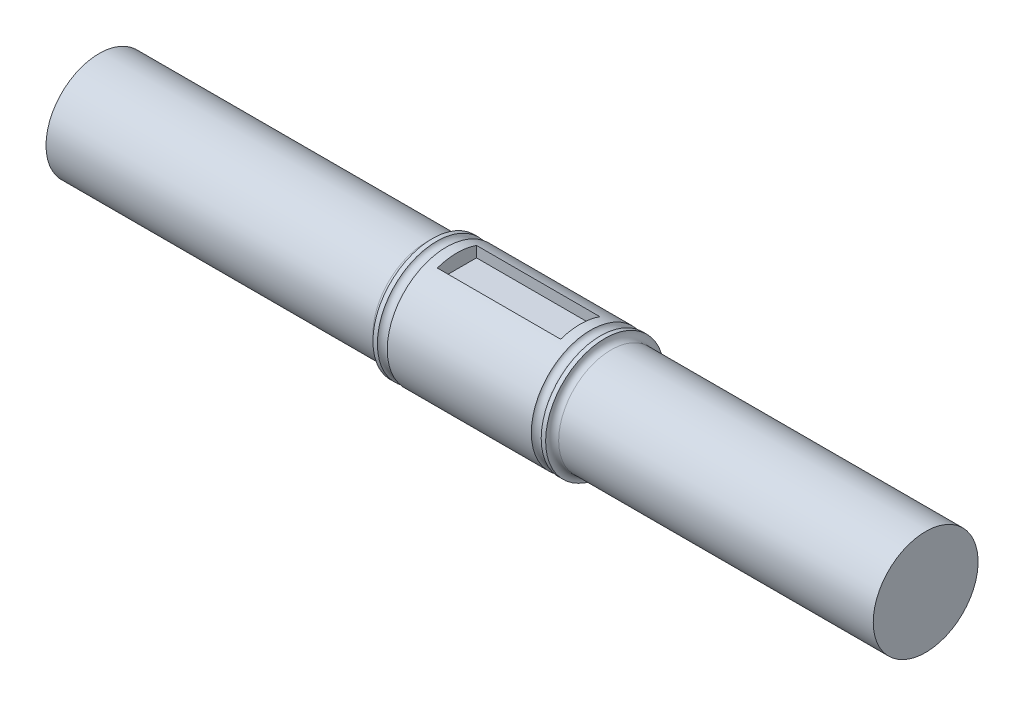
SolidWorks part; units mm, degrees
ref_plane "Front Plane" through (0, 0, 0) normal (0, 0, 1) x (1, 0, 0)
ref_plane "Top Plane" through (0, 0, 0) normal (0, 1, 0) x (1, 0, 0)
ref_plane "Right Plane" through (0, 0, 0) normal (1, 0, 0) x (0, 0, -1)
sketch "Sketch2" plane through (0, 0, 0) normal (0, 0, 1) x (1, 0, 0)
  line L0 (6.6532, 0.911) -> (6.6532, 9.5242)
  line L4 (6.6532, 0.911) -> (59.6532, 0.911)
  line L5 (6.6532, 9.5242) -> (140.6532, 9.5242) construction
  line L6 (60.6532, -0.089) -> (61.3767, -0.089)
  line L8 (87.9332, -0.089) -> (88.6532, -0.089)
  line L9 (89.6532, 1.0242) -> (140.6532, 1.0242)
  line L11 (140.6532, 1.0242) -> (140.6532, 9.5242)
  line L22 (62.9767, -0.089) -> (86.3332, -0.089)
  arc A0 (88.6532, -0.089) -> (89.6532, 1.0242) centre (89.6468, 0.0242) cw
  arc A1 (61.3767, -0.089) -> (62.9767, -0.089) centre (62.1767, -0.479) cw
  arc A2 (86.3332, -0.089) -> (87.9332, -0.089) centre (87.1332, -0.4808) cw
  arc A3 (60.6532, -0.089) -> (59.6532, 0.911) centre (59.6532, -0.089) ccw
  dimension "D3" = 8.5
  dimension "D4" = 1
  dimension "D6" = 1
  dimension "D8" = 0.72
  dimension "D1" = 53
  dimension "D2" = 51
  dimension "D5" = 28
  dimension "D7" = 0.7235
  dimension "D9" = 1.6
revolve "Revolve2" add sketch "Sketch2" angle 360 about L5
ref_plane "Plane1" through (74.6532, 0, 0) normal (-1, 0, 0) x (0, 0, 1)
sketch "Sketch8" plane through (74.6532, 0, 0) normal (-1, 0, 0) x (0, 0, 1)
  line L0 (0, 18.9043) -> (0, 0) construction
  line L1 (-3.175, 16.8498) -> (3.175, 16.8498)
  line L2 (3.175, 16.8498) -> (3.175, 19.2118)
  line L3 (-3.175, 16.8498) -> (-3.175, 19.2118)
  line L4 (-3.175, 19.2118) -> (3.175, 19.2118)
  dimension "D1" = 6.35
  dimension "D2" = 2.362
extrude "Cut-Extrude1" cut sketch "Sketch8" against normal blind 10 and the other way blind 10
